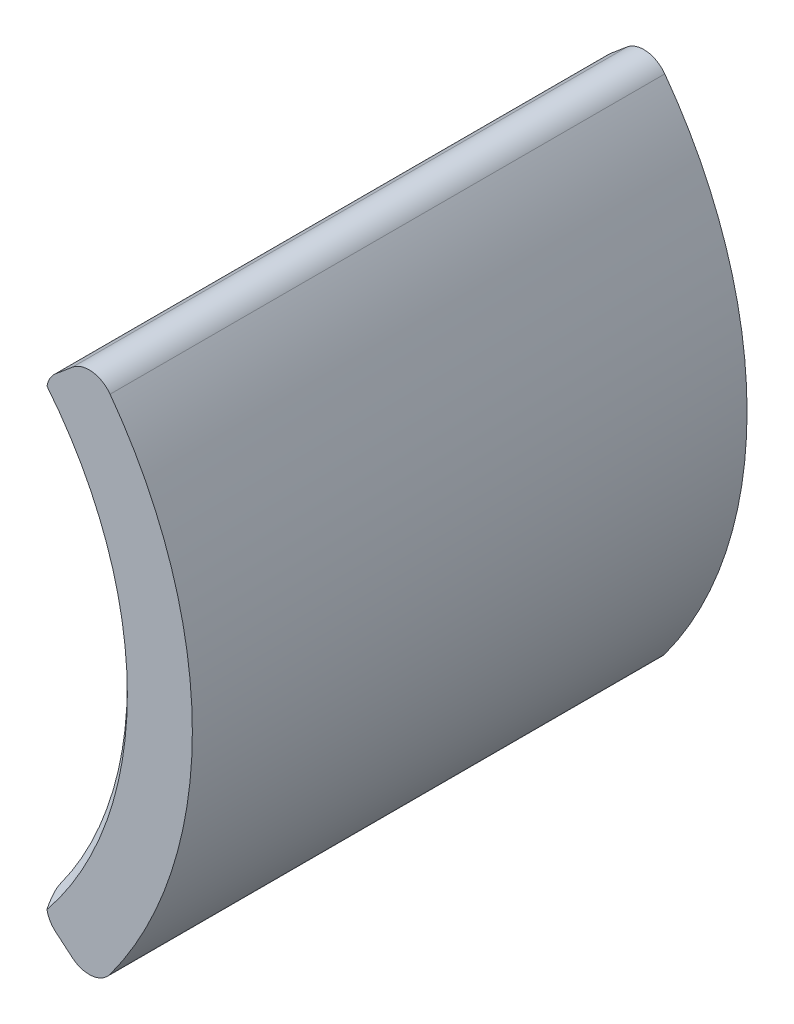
SolidWorks part; units mm, degrees
ref_plane "Plan de face" through (0, 0, 0) normal (0, 0, 1) x (1, 0, 0)
ref_plane "Plan de dessus" through (0, 0, 0) normal (0, 1, 0) x (1, 0, 0)
ref_plane "Plan de droite" through (0, 0, 0) normal (1, 0, 0) x (0, 0, -1)
sketch "Esquisse1" plane through (0, 0, 0) normal (0, 0, 1) x (1, 0, 0)
  line L0 (49, 0) -> (40.5, 0)
  line L1 (31.0248, 26.0329) -> (37.5362, 31.4966)
  line L2 (0, 0) -> (58.0711, 0) construction
  line L3 (58.0711, 0) -> (0, 0) construction
  line L4 (0, 0) -> (47.6914, 47.6914) construction
  arc A0 (49, 0) -> (37.5362, 31.4966) centre (0, 0) ccw
  arc A1 (40.5, 0) -> (31.0248, 26.0329) centre (0, 0) ccw
  dimension "D1" = 98
  dimension "D2" = 81
  dimension "D3" = 45
  dimension "D4" = 5
extrude "Extrusion1" add sketch "Esquisse1" along normal blind 64
mirror "Symétrie1" about plane through (49, 0, 64) normal (0, 1, 0) of "Extrusion1"
chamfer "Chanfrein1" distance 1 angle 45 2 edges at (40.5, 0, 0) (40.5, 0, 64)
fillet "Congé1" radius 3 4 edges at (31.0248, 26.0329, 32) (37.5362, 31.4966, 32) (37.5362, -31.4966, 32) (31.0248, -26.0329, 32)
